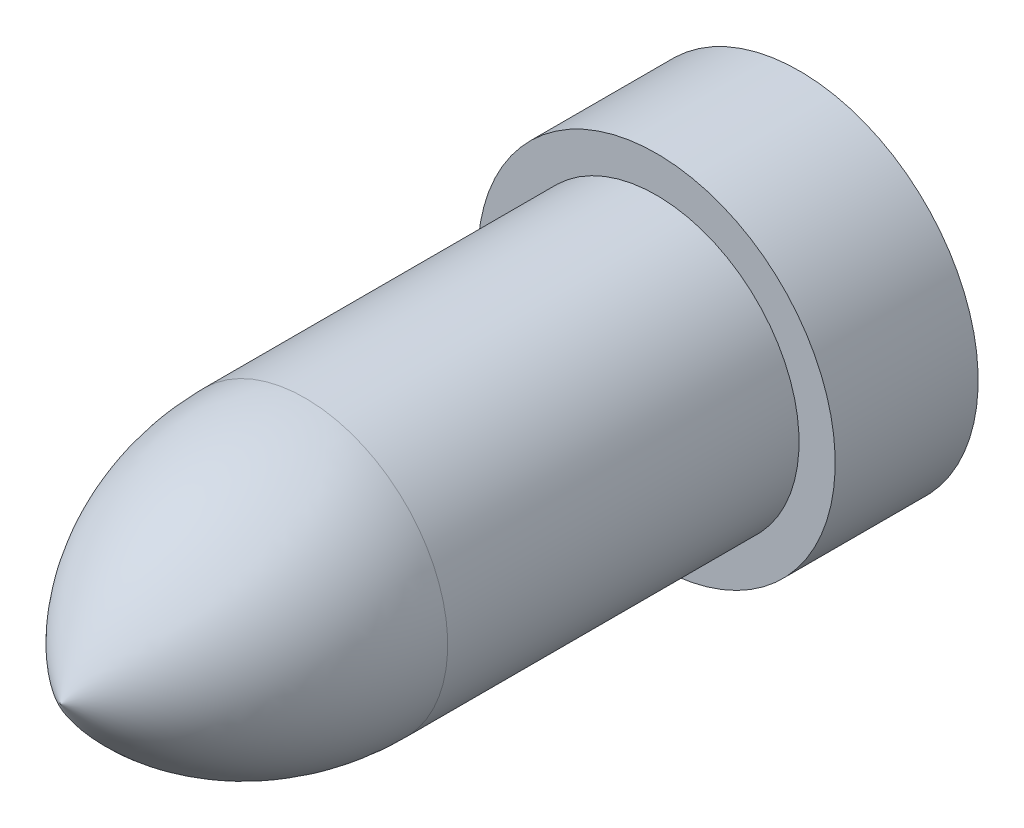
SolidWorks part; units mm, degrees
ref_plane "Front" through (0, 0, 0) normal (0, 0, 1) x (1, 0, 0)
ref_plane "Top" through (0, 0, 0) normal (0, 1, 0) x (1, 0, 0)
ref_plane "Right" through (0, 0, 0) normal (1, 0, 0) x (0, 0, -1)
sketch "Logo3_Revol_Axis" plane through (0, 0, 0) normal (0, 1, 0) x (1, 0, 0)
  line L0 (0, -30.1653) -> (0, 30.1653) construction
sketch "Logo3_bib1" plane through (0, 0, 0) normal (0, -1, 0) x (-1, 0, 0)
  line L0 (4.7625, 0) -> (5.969, 0)
  line L1 (0, 4.7752) -> (5.969, 4.7752)
  line L2 (0, 4.7752) -> (0, -10.4648)
  line L3 (0, -10.4648) -> (4.7625, -10.4648) construction
  line L4 (4.7625, 0) -> (4.7625, -10.4648)
  line L5 (5.969, 0) -> (5.969, 4.7752)
  line L6 (0, -16.8148) -> (2.5, -16.8148) construction
  line L7 (0, -10.4648) -> (0, -19.91)
  line L8 (4.7625, -10.4648) -> (4.7625, -11.7348)
  line L9 (4.7625, -11.7348) -> (0, -11.7348) construction
  line L10 (0, 41.5372) -> (0, -40.1764) construction
  arc A0 (0, -19.91) -> (4.7625, -11.7348) centre (-4.6355, -11.7348) ccw
  ellipse E0 centre (0, -11.7348) end of major axis (0, -16.8148) minor radius 4.7625 (0, -16.8148) -> (4.7625, -11.7348) ccw construction
  dimension "D1" = 4.7752
  dimension "D2" = 9.398
  dimension "D3" = 11.938
  dimension "D4" = 9.525
  dimension "D5" = 11.7348
  dimension "D6" = 10.4648
revolve "Revolve1" add sketch "Logo3_bib1" angle 360 about L10
sketch "Logo3_bib2" [suppressed] plane through (0, 0, 0) normal (0, 1, 0) x (1, 0, 0)
  line L0 (0, 0) -> (0, -28) construction
  line L1 (0, 1.524) -> (5.0962, 1.524)
  line L2 (5.0962, 1.524) -> (5.0962, 0)
  line L3 (3.556, -8.2588) -> (3.556, -26.416) construction
  line L4 (5.0962, 0) -> (3.556, 0)
  line L5 (0, -20.066) -> (0, -26.416)
  line L6 (3.556, 0) -> (3.556, -8.2588)
  line L7 (3.556, -20.066) -> (0, -20.066) construction
  line L8 (0, 1.524) -> (0, -20.066)
  line L9 (2.032, -20.066) -> (2.032, -22.352)
  line L10 (2.032, -20.066) -> (2.032, -14.291)
  line L11 (2.032, -14.291) -> (3.556, -8.2588) construction
  line L12 (0, -26.416) -> (3.556, -26.416) construction
  line L13 (0, -20.066) -> (3.556, -26.416) construction
  line L14 (2.032, -22.352) -> (0, -22.352) construction
  arc A0 (2.032, -14.291) -> (3.556, -8.2588) centre (14.732, -14.291) cw
  ellipse E0 centre (0, -22.352) end of major axis (0, -26.416) minor radius 2.032 (0, -26.416) -> (2.032, -22.352) ccw
  dimension "D1" = 12.7
  dimension "logo3_punch_d" = 4.2215
  dimension "logo3_punch_l" = 11.8072
  dimension "D2" = 2.286
  dimension "logo3_l1" = 238.125
  dimension "logo3_head_l" = 4.7752
  dimension "logo3_head_d" = 12.7
  dimension "logo3_d1" = 9.525
  dimension "logo3_nose_l" = 6.35
revolve "Revolve-shoulder" [suppressed] add sketch "Logo3_bib2" angle 360 about L0
